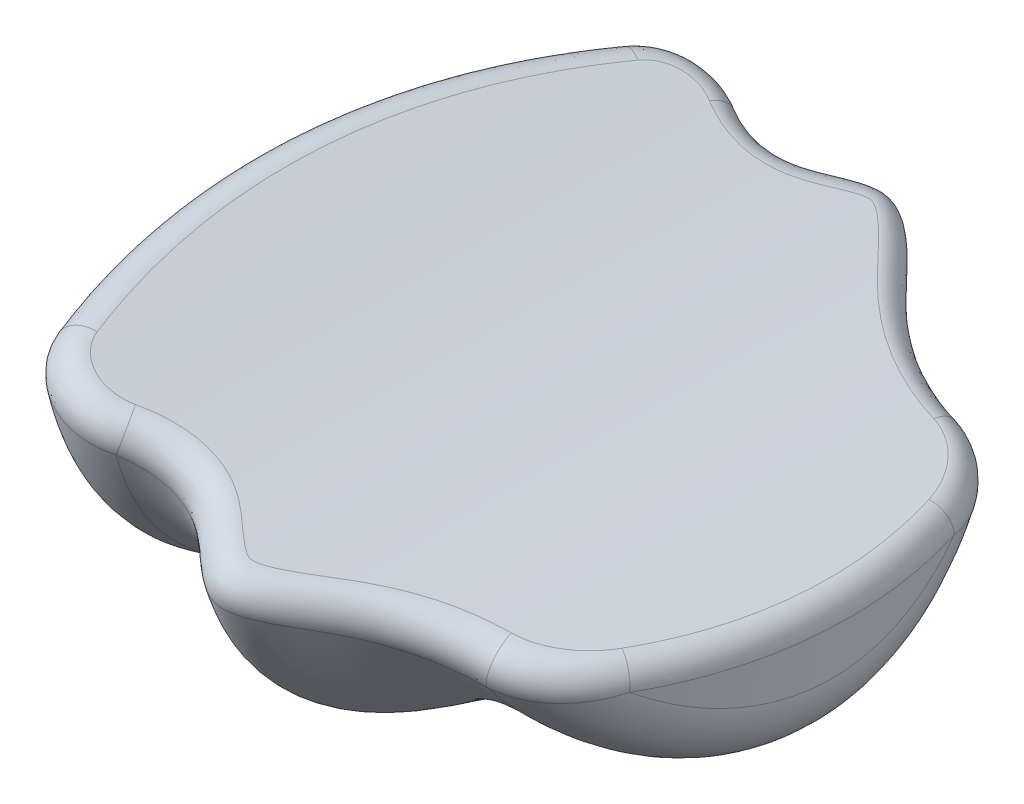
SolidWorks part; units mm, degrees
ref_plane "Front Plane" through (0, 0, 0) normal (0, 0, 1) x (1, 0, 0)
ref_plane "Top Plane" through (0, 0, 0) normal (0, 1, 0) x (1, 0, 0)
ref_plane "Right Plane" through (0, 0, 0) normal (1, 0, 0) x (0, 0, -1)
sketch "Sketch1" plane through (0, 0, 0) normal (0, 1, 0) x (1, 0, 0)
  arc A0 (45.2083, 152.7931) -> (16.9071, -152.7931) centre (-76.9251, 10.0006) cw
sketch "Sketch2" plane through (0, 0, 0) normal (0, 1, 0) x (1, 0, 0)
  arc A0 (-50.987, 159.108) -> (-62.5787, -172.0756) centre (203.4811, -15.5933) ccw
sketch "Sketch3" plane through (0, 0, 0) normal (0, 0, 1) x (1, 0, 0)
  spline S0 degree 3 poles (-162.1743, 123.5832) (-107.3956, 99.7164) (-9.5856, 57.1011) (94.698, 34.9815) (140.5774, 25.2501) knots 0 0 0 0 0.560052 1 1 1 1
sketch "Sketch4" plane through (0, 0, 0) normal (0, 0, 1) x (1, 0, 0)
  line L0 (-422.8188, 161.276) -> (280.6291, 60.2785) construction
  spline S0 degree 3 poles (123.5095, -36.9456) (89.6457, -23.8296) (42.3708, -5.5192) (-12.3836, -56.0446) (-52.2702, 5.6661) (-95.8333, -39.6164) (-131.0903, -76.265) knots 0 0 0 0 0.367027 0.512381 0.605354 1 1 1 1
surface "Surface-Extrude1" sketch "Sketch3" parameters "D1"=304.8
surface "Surface-Extrude2" sketch "Sketch1" parameters "D1"=203.2
surface "Surface-Revolve1" sketch "Sketch4" parameters "D1"=218, "D2"=180
surface "Surface-Extrude3" sketch "Sketch2" parameters "D1"=192.024, "D2"=105.41
surface "Surface-Trim1"
fillet "Fillet1" radius 27.94 6 edges at (109.9353, -31.3334, 9.7344) (-3.9543, 60.9599, 138.3042) (-105.0353, -49.8776, 5.9919) (1.7622, 59.1617, -139.9788) (-102.4543, 97.9127, 56.5577) (110.7599, 31.6177, -18.9789)
fillet "Fillet2" radius 10.16 12 edges at (103.4416, 33.2102, 42.6694) (110.3961, 5.4957, 4.732) (1.7622, 59.1617, -139.9788) (-102.4543, 97.9127, 56.5577) (-3.9543, 60.9599, 138.3042) (-71.4591, 85.2755, 130.2832) (-63.1892, 82.033, -124.5081) (74.1846, 39.8108, 94.8085) (85.3952, 37.2287, -92.5222) (-66.7602, -22.0675, 7.7646) (77.1937, -21.9141, 3.4018) (-105.0165, 3.8524, 5.4076)
